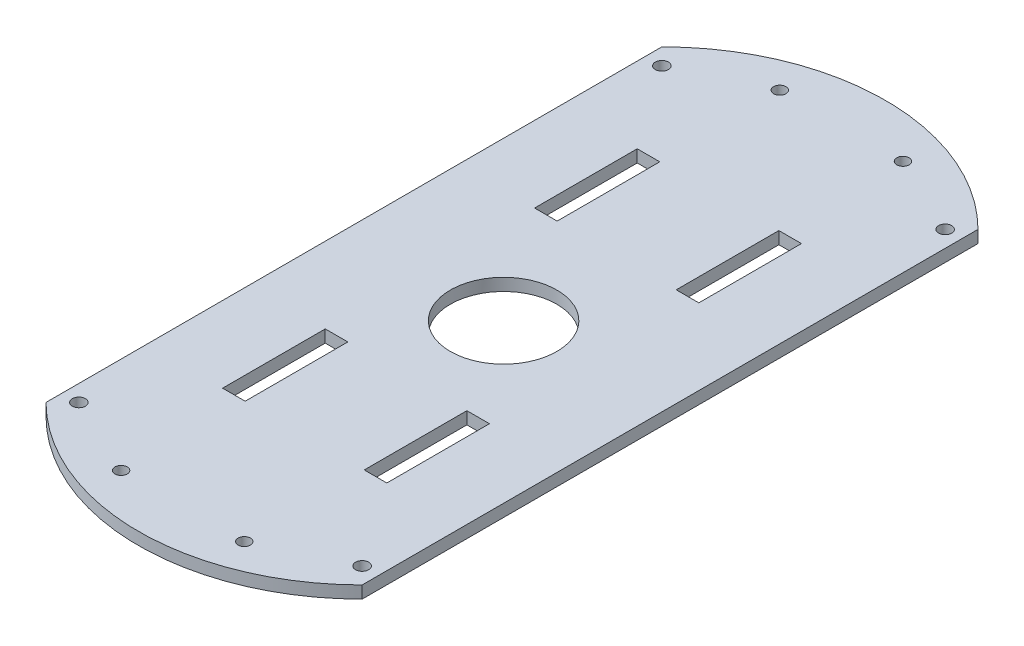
SolidWorks part; units mm, degrees
ref_plane "Front Plane" through (0, 0, 0) normal (0, 0, 1) x (1, 0, 0)
ref_plane "Top Plane" through (0, 0, 0) normal (0, 1, 0) x (1, 0, 0)
ref_plane "Right Plane" through (0, 0, 0) normal (1, 0, 0) x (0, 0, -1)
sketch "Sketch1" plane through (0, 0, 0) normal (0, 1, 0) x (1, 0, 0)
  line L0 (38.5, -150) -> (38.5, -155.2077) construction
  line L2 (0, 0) -> (0, -150)
  line L4 (77, 0) -> (77, -150)
  arc A0 (0, 0) -> (77, 0) centre (38.5, -38.5) cw
  arc A1 (77, -150) -> (0, -150) centre (38.5, -111.5) cw
  dimension "D1" = 77
  dimension "D2" = 150
extrude "Boss-Extrude2" add sketch "Sketch1" along normal blind 3
sketch "Sketch4" plane through (0, 3, 0) normal (0, 1, 0) x (1, 0, 0)
  line L0 (38.5, 15.9472) -> (38.5, -170.0423) construction
  line L1 (73, -142) -> (73, -150) construction
  line L2 (69, -146) -> (77, -146) construction
  line L17 (4, 0) -> (4, -8) construction
  line L18 (73, -2.4) -> (73, -5.6) construction
  line L19 (74.6, -4) -> (71.4, -4) construction
  line L20 (0, -146) -> (8, -146) construction
  line L21 (0, 0) -> (0, -150) construction
  line L22 (18.5, -24.5) -> (24, -24.5)
  line L23 (18.5, -24.5) -> (18.5, -49.5)
  line L24 (18.5, -49.5) -> (24, -49.5)
  line L25 (24, -24.5) -> (24, -49.5)
  line L26 (77, -150) -> (77, 0) construction
  line L27 (58.5, -24.5) -> (53, -24.5)
  line L28 (58.5, -24.5) -> (58.5, -49.5)
  line L29 (58.5, -49.5) -> (53, -49.5)
  line L30 (53, -24.5) -> (53, -49.5)
  line L31 (8, -4) -> (2.4, -4) construction
  line L32 (18.5, -100.49) -> (24, -100.49)
  line L33 (18.5, -100.49) -> (18.5, -125.49)
  line L34 (18.5, -125.49) -> (24, -125.49)
  line L35 (24, -100.49) -> (24, -125.49)
  line L36 (55.7249, -100.49) -> (61.2249, -100.49)
  line L37 (55.7249, -100.49) -> (55.7249, -125.49)
  line L38 (55.7249, -125.49) -> (61.2249, -125.49)
  line L39 (61.2249, -100.49) -> (61.2249, -125.49)
  line L40 (4, -142) -> (4, -150) construction
  arc A0 (77, 0) -> (0, 0) centre (38.5, -38.5) ccw construction
  circle A1 centre (38.5, -77.0475) radius 12.9674
  circle A2 centre (4, -4) radius 1.6
  circle A3 centre (73, -4) radius 1.6
  circle A4 centre (4, -146) radius 1.6
  circle A5 centre (73, -146) radius 1.6
  circle A6 centre (23.5, 5.218) radius 1.5
  circle A7 centre (53.5, 5.218) radius 1.5
  circle A8 centre (23.5, -155.208) radius 1.5
  circle A9 centre (53.5, -155.208) radius 1.5
  point P50 (18.5, -37)
  dimension "D8" = 3.2
  dimension "D9" = 3.2
  dimension "D10" = 3.2
  dimension "D11" = 3.2
  dimension "D27" = 3
  dimension "D28" = 3
  dimension "D32" = 3
  dimension "D33" = 3
  dimension "D12" = 18.5
  dimension "D14" = 5.5
  dimension "D15" = 25
  dimension "D16" = 18.5
  dimension "D17" = 5.5
  dimension "D18" = 25
  dimension "D20" = 5.5
  dimension "D21" = 25
  dimension "D22" = 30
  dimension "D23" = 15
  dimension "D24" = 29.718
  dimension "D25" = 29.718
  dimension "D26" = 29.718
  dimension "D29" = 29.718
  dimension "D30" = 30
  dimension "D31" = 15
extrude "Cut-Extrude1" cut sketch "Sketch4" against normal blind 101.72
sketch "Sketch9" plane through (0, 3, 0) normal (0, 1, 0) x (1, 0, 0)
  line L2 (55.7249, -100.49) -> (61.2249, -100.49)
  line L3 (55.7249, -100.49) -> (55.7249, -125.49)
  line L4 (55.7249, -125.49) -> (61.2249, -125.49)
  line L5 (61.2249, -100.49) -> (61.2249, -125.49)
extrude "Boss-Extrude4" add sketch "Sketch9" against normal blind 3
sketch "Sketch11" plane through (0, 3, 0) normal (0, 1, 0) x (1, 0, 0)
  line L0 (18.5, -125.49) -> (18.5, -14.6584) construction
  line L1 (58.5, -24.5) -> (58.5, -150.5858) construction
  line L2 (18.5, -125.49) -> (78.1172, -125.49) construction
  line L4 (53, -24.5) -> (53, -125.49) construction
  line L5 (18.5, -100.49) -> (77, -100.49) construction
  line L6 (77, -150) -> (77, 0) construction
  line L8 (53, -125.49) -> (58.5, -125.49)
  line L9 (53, -125.49) -> (53, -100.49)
  line L10 (53, -100.49) -> (58.5, -100.49)
  line L11 (58.5, -125.49) -> (58.5, -100.49)
extrude "Cut-Extrude3" cut sketch "Sketch11" against normal blind 3
sketch "Sketch12" plane through (0, 0, 0) normal (0, -1, 0) x (1, 0, 0)
  line L0 (18.5, 125.49) -> (18.5, 16.691) construction
  line L1 (58.5, 125.49) -> (58.5, 14.6584) construction
